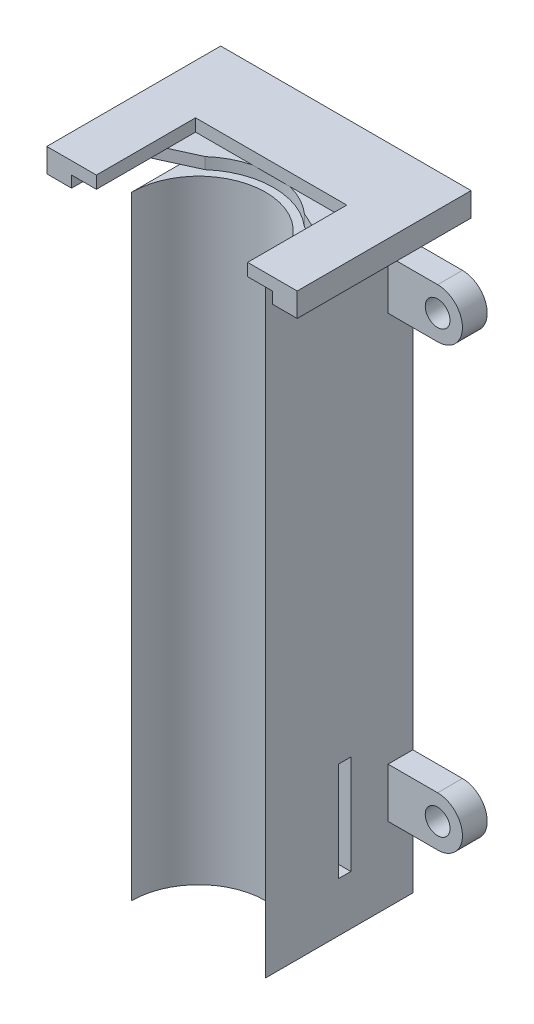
SolidWorks part; units mm, degrees
ref_plane "Front Plane" through (0, 0, 0) normal (0, 0, 1) x (1, 0, 0)
ref_plane "Top Plane" through (0, 0, 0) normal (0, 1, 0) x (1, 0, 0)
ref_plane "Right Plane" through (0, 0, 0) normal (1, 0, 0) x (0, 0, -1)
sketch "Sketch1" plane through (0, 1004.3504, 0) normal (0, 1, 0) x (1, 0, 0)
  line L0 (357.5407, -1279.6695) -> (357.5407, -1293.3048) construction
  line L1 (370.557, -1272.0853) -> (359.0243, -1277.3596) construction
  line L2 (407.4921, -1277.3596) -> (395.9594, -1272.0853) construction
  line L3 (408.9757, -1293.3048) -> (408.9757, -1279.6695) construction
  line L4 (357.5407, -1279.6695) -> (357.5407, -1293.3048)
  line L5 (370.557, -1272.0853) -> (359.0243, -1277.3596)
  line L6 (407.4921, -1277.3596) -> (395.9594, -1272.0853)
  line L7 (408.9757, -1293.3048) -> (408.9757, -1279.6695)
  line L8 (408.9757, -1293.3048) -> (415.3257, -1293.3048)
  line L9 (415.3257, -1293.3048) -> (415.3257, -1248.763)
  line L10 (415.3257, -1248.763) -> (351.1907, -1248.763)
  line L11 (351.1907, -1248.763) -> (351.1907, -1293.3048)
  line L12 (351.1907, -1293.3048) -> (357.5407, -1293.3048)
  line L13 (412.1507, -1248.763) -> (513.0007, -1248.763) construction
  arc A0 (359.0243, -1277.3596) -> (357.5407, -1279.6695) centre (360.0807, -1279.6695) ccw construction
  arc A1 (395.9594, -1272.0853) -> (370.557, -1272.0853) centre (383.2582, -1286.4871) ccw construction
  arc A2 (408.9757, -1279.6695) -> (407.4921, -1277.3596) centre (406.4357, -1279.6695) ccw construction
  arc A3 (359.0243, -1277.3596) -> (357.5407, -1279.6695) centre (360.0807, -1279.6695) ccw
  arc A4 (395.9594, -1272.0853) -> (370.557, -1272.0853) centre (383.2582, -1286.4871) ccw
  arc A5 (408.9757, -1279.6695) -> (407.4921, -1277.3596) centre (406.4357, -1279.6695) ccw
  dimension "D1" = 6.35
  dimension "D2" = 6.35
extrude "Boss-Extrude1" add sketch "Sketch1" against normal up to vertex (2.921 mm away)
sketch "Sketch2" plane through (0, 1004.3504, 0) normal (0, 1, 0) x (1, 0, 0)
  line L0 (415.3257, -1293.3048) -> (402.6257, -1293.3048)
  line L1 (402.6257, -1293.3048) -> (402.6257, -1267.9048)
  line L2 (402.6257, -1267.9048) -> (363.8907, -1267.9048)
  line L3 (351.1907, -1293.3048) -> (363.8907, -1293.3048)
  line L4 (363.8907, -1293.3048) -> (363.8907, -1267.9048)
  line L5 (415.3257, -1293.3048) -> (415.3257, -1248.763)
  line L6 (415.3257, -1248.763) -> (351.1907, -1248.763)
  line L7 (351.1907, -1248.763) -> (351.1907, -1293.3048)
  dimension "D1" = 12.7
  dimension "D2" = 12.7
  dimension "D3" = 25.4
extrude "Boss-Extrude2" add sketch "Sketch2" along normal blind 3.175
sketch "Sketch3" plane through (0, 1001.4294, 0) normal (0, -1, 0) x (1, 0, 0)
  line L0 (366.1132, 1286.4871) -> (366.1132, 1248.763)
  line L1 (415.3257, 1248.763) -> (351.1907, 1248.763) construction
  line L2 (366.1132, 1248.763) -> (400.4032, 1248.763)
  line L3 (400.4032, 1248.763) -> (400.4032, 1286.4871)
  circle A0 centre (383.2582, 1286.4871) radius 17.145 construction
  arc A1 (366.1132, 1286.4871) -> (400.4032, 1286.4871) centre (383.2582, 1286.4871) ccw
extrude "Boss-Extrude3" add sketch "Sketch3" along normal blind 157.1625
sketch "Sketch4" plane through (0, 0, 1248.763) normal (0, 0, -1) x (-1, 0, 0)
  line L5 (-400.4032, 844.2669) -> (-400.4032, 1001.4294) construction
  line L6 (-400.4032, 988.7294) -> (-413.1032, 988.7294)
  line L7 (-400.4032, 988.7294) -> (-400.4032, 976.0294)
  line L8 (-400.4032, 976.0294) -> (-413.1032, 976.0294)
  line L10 (-415.3257, 1001.4294) -> (-400.4032, 1001.4294) construction
  line L11 (-383.2582, 1007.5254) -> (-383.2582, 844.2669) construction
  line L12 (-415.3257, 1007.5254) -> (-351.1907, 1007.5254) construction
  line L13 (-366.1132, 844.2669) -> (-400.4032, 844.2669) construction
  line L14 (-366.1132, 976.0294) -> (-353.4132, 976.0294)
  line L15 (-366.1132, 988.7294) -> (-366.1132, 976.0294)
  line L16 (-366.1132, 988.7294) -> (-353.4132, 988.7294)
  line L17 (-400.4032, 976.0294) -> (-400.4032, 863.3169) construction
  line L18 (-400.4032, 919.6731) -> (-366.1132, 919.6731) construction
  line L19 (-366.1132, 844.2669) -> (-366.1132, 1001.4294) construction
  line L20 (-400.4032, 863.3169) -> (-413.1032, 863.3169)
  line L22 (-413.1032, 876.0169) -> (-400.4032, 876.0169)
  line L23 (-400.4032, 876.0169) -> (-400.4032, 863.3169)
  line L24 (-366.1132, 876.0169) -> (-366.1132, 863.3169)
  line L25 (-353.4132, 876.0169) -> (-366.1132, 876.0169)
  line L26 (-366.1132, 863.3169) -> (-353.4132, 863.3169)
  arc A2 (-413.1032, 988.7294) -> (-413.1032, 976.0294) centre (-413.1032, 982.3794) ccw
  circle A3 centre (-413.1032, 982.3794) radius 3.175
  circle A4 centre (-353.4132, 982.3794) radius 3.175
  arc A5 (-353.4132, 988.7294) -> (-353.4132, 976.0294) centre (-353.4132, 982.3794) cw
  arc A6 (-413.1032, 863.3169) -> (-413.1032, 876.0169) centre (-413.1032, 869.6669) cw
  circle A7 centre (-413.1032, 869.6669) radius 3.175
  circle A8 centre (-353.4132, 869.6669) radius 3.175
  arc A9 (-353.4132, 863.3169) -> (-353.4132, 876.0169) centre (-353.4132, 869.6669) ccw
  point P35 (-414.5037, 844.2669)
  point P42 (0, 0)
  point P43 (-400.4032, 853.8076)
  dimension "D2" = 12.7
  dimension "D4" = 6.35
  dimension "D5" = 6.35
  dimension "D1" = 12.7
  dimension "D3" = 12.7
  dimension "D6" = 19.05
extrude "Boss-Extrude4" add sketch "Sketch4" against normal blind 6.35
sketch "Sketch8" plane through (400.4032, 0, 0) normal (1, 0, 0) x (0, 0, -1)
  line L0 (-1255.113, 869.6669) -> (-1286.4871, 869.6669) construction
  line L1 (-1264.638, 856.9669) -> (-1267.813, 856.9669)
  line L2 (-1264.638, 856.9669) -> (-1264.638, 882.3669)
  line L3 (-1264.638, 882.3669) -> (-1267.813, 882.3669)
  line L4 (-1267.813, 856.9669) -> (-1267.813, 882.3669)
  line L5 (-1255.113, 863.3169) -> (-1255.113, 876.0169) construction
  line L6 (-1286.4871, 844.2669) -> (-1286.4871, 1001.4294) construction
  point P10 (-1264.638, 869.6669)
  point P11 (-1264.638, 884.0175)
  dimension "D1" = 3.175
  dimension "D2" = 9.525
  dimension "D3" = 25.4
extrude "Cut-Extrude2" cut sketch "Sketch8" against normal through all
